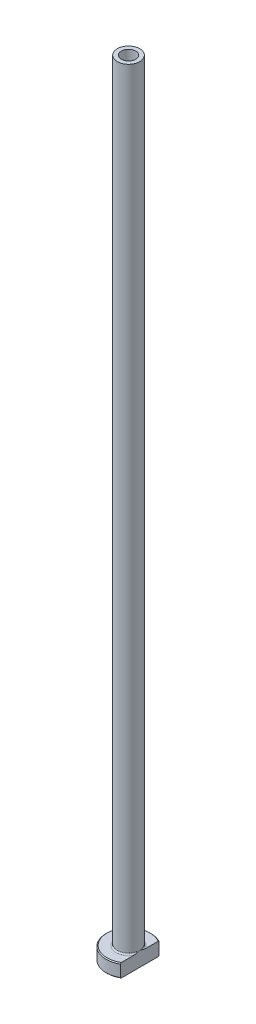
SolidWorks part; units mm, degrees
ref_plane "Front Plane" through (0, 0, 0) normal (0, 0, 1) x (1, 0, 0)
ref_plane "Top Plane" through (0, 0, 0) normal (0, 1, 0) x (1, 0, 0)
ref_plane "Right Plane" through (0, 0, 0) normal (1, 0, 0) x (0, 0, -1)
sketch "Sketch1" plane through (0, 0, 0) normal (0, 0, 1) x (1, 0, 0)
  line L0 (-1.6, 175) -> (-2.5, 175)
  line L1 (-2.5, 175) -> (-2.5, 3)
  line L2 (-2.5, 3) -> (-5, 3)
  line L3 (-5, 3) -> (-5, 0)
  line L4 (4.125, 0) -> (-4.125, 0) construction
  line L5 (-5, 0) -> (-1.85, 0)
  line L6 (-1.6, 130) -> (-1.6, 175)
  line L7 (0, 92.1877) -> (0, -15.5353) construction
  line L8 (0, -5.5) -> (0, 5.5) construction
  line L9 (-1.6, 130) -> (-1.85, 118)
  line L10 (-1.85, 118) -> (-1.85, 0)
  dimension "D1" = 0.25
  dimension "ID" = 3.2
  dimension "OD" = 5
  dimension "L" = 175
  dimension "H" = 10
  dimension "T" = 3
  dimension "N" = 45
  dimension "D2" = 12
  dimension "L-N" = 130
revolve "Revolve1" add sketch "Sketch1" angle 360 about L7
fillet "Fillet1" radius 0.3 1 edges at (0, 3, 2.5)
chamfer "Chamfer1" distance 0.2 angle 45 2 edges at (0, 3, 5) (0, 0, 5)
sketch "Sketch2" plane through (0, 0, 0) normal (0, -1, 0) x (1, 0, 0)
  line L0 (2.5, 4.3301) -> (2.5, -4.3301)
  circle A0 centre (0, 0) radius 5 construction
  arc A1 (2.5, 4.3301) -> (2.5, -4.3301) centre (0, 0) cw
  circle A2 centre (0, 0) radius 2.5 construction
extrude "Cut-Extrude1" cut sketch "Sketch2" against normal through all
chamfer "Chamfer2" distance 0.5 angle 45 1 edges at (0, 0, 1.85)
